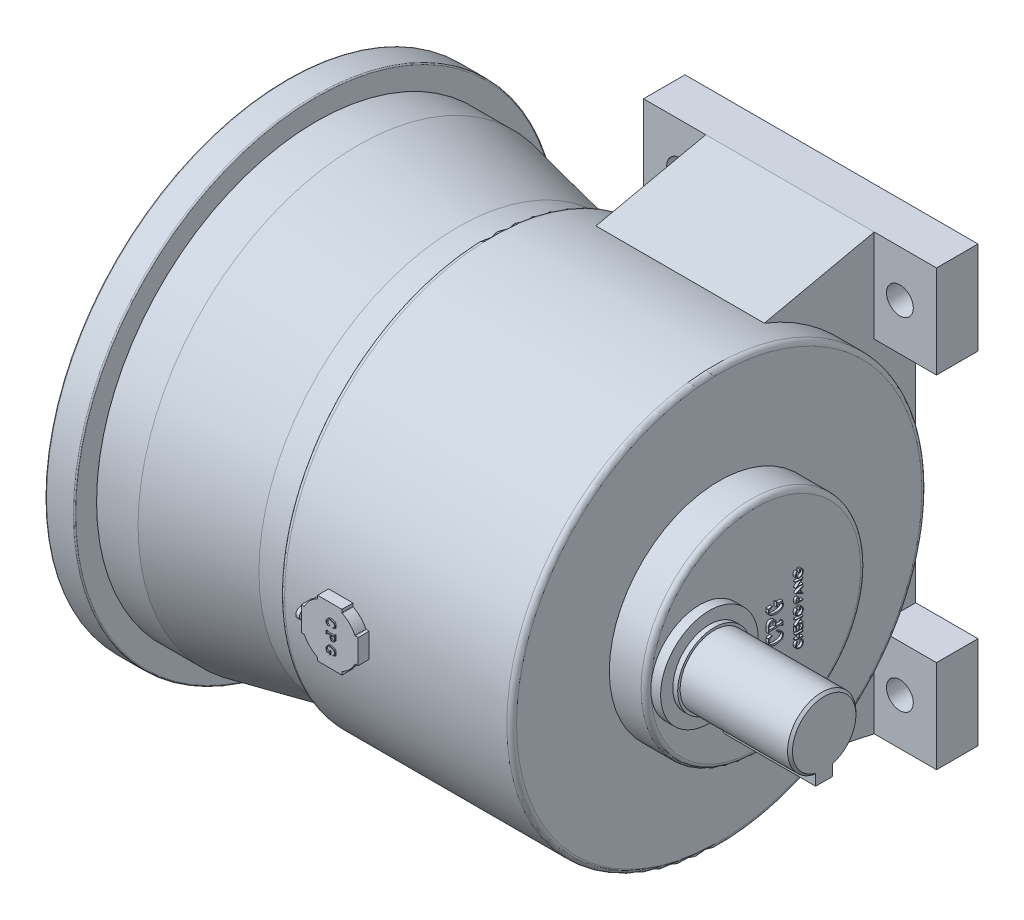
SolidWorks part; units mm, degrees
ref_plane "前视基准面" through (0, 0, 0) normal (0, 0, 1) x (1, 0, 0)
ref_plane "上视基准面" through (0, 0, 0) normal (0, 1, 0) x (1, 0, 0)
ref_plane "右视基准面" through (0, 0, 0) normal (1, 0, 0) x (0, 0, -1)
ref_plane "基准面1" through (0, 0, -116) normal (0, 0, 1) x (1, 0, 0)
sketch "草图1" plane through (0, 0, 0) normal (0, 1, 0) x (1, 0, 0)
  line L0 (0, 0) -> (33.1729, 0) construction
  line L1 (0, 0) -> (0, -14)
  line L2 (0, -14) -> (-45, -14)
  line L3 (-45, -14) -> (-45, -15)
  line L4 (-45, -15) -> (-47, -15)
  line L5 (-47, -15) -> (-47, -20)
  line L6 (-47, -20) -> (-51, -20)
  line L7 (-51, -20) -> (-51, 0)
  line L8 (-51, 0) -> (0, 0)
  dimension "D1" = 45
  dimension "D2" = 28
  dimension "D3" = 30
  dimension "D4" = 2
  dimension "D5" = 40
  dimension "D6" = 4
revolve "旋转1" add sketch "草图1" angle 360 about L0
sketch "草图2" plane through (0, 0, 0) normal (0, 1, 0) x (1, 0, 0)
  line L0 (8.0167, 23) -> (-51, 23) construction
  line L1 (-51, 23) -> (-51, -22)
  line L2 (-51, 20) -> (-51, -20) construction
  line L3 (-51, -22) -> (-66, -22)
  line L4 (-66, -22) -> (-66, -62)
  line L5 (-66, -62) -> (-161, -62)
  line L6 (-161, -62) -> (-161, 23)
  line L11 (-51, 23) -> (-161, 23)
  line L13 (-103.125, 116) -> (103.125, 116) construction
  dimension "D1" = 23
  dimension "D2" = 90
  dimension "D3" = 15
  dimension "D4" = 178
  dimension "D5" = 95
revolve "旋转2" add sketch "草图2" angle 360 about L0
sketch "草图3" plane through (0, 0, -116) normal (0, 0, 1) x (1, 0, 0)
  line L0 (0, 0) -> (40.0459, 0) construction
  line L1 (-173, -51) -> (-53, -51)
  line L2 (-173, -51) -> (-173, -89)
  line L3 (-173, -89) -> (-53, -89)
  line L4 (-53, -51) -> (-53, -89)
  line L5 (0, -14) -> (0, 14) construction
  circle A0 centre (-68, -70) radius 5.5
  circle A1 centre (-158, -70) radius 5.5
  dimension "D2" = 140
  dimension "D3" = 11
  dimension "D4" = 90
  dimension "D6" = 68
  dimension "D8" = 38
  dimension "D1" = 178
  dimension "D5" = 120
  dimension "D7" = 15
extrude "拉伸2" add sketch "草图3" along normal blind 17
mirror "镜向2" about plane through (0, 0, 0) normal (0, 1, 0)
ref_plane "基准面4" through (-113, 0, 0) normal (1, 0, 0) x (0, 0, -1)
sketch "草图4" plane through (-113, 0, 0) normal (1, 0, 0) x (0, 0, -1)
  line L0 (99, 51) -> (116, 51) construction
  line L1 (99, 51) -> (116, 51)
  line L2 (99, 89) -> (99, 51) construction
  line L3 (99, 89) -> (99, 51)
  line L4 (99, -51) -> (116, -51) construction
  line L5 (99, -51) -> (116, -51)
  line L6 (99, -89) -> (99, -51) construction
  line L7 (99, -89) -> (99, -51)
  line L8 (116, 51) -> (116, -51)
  line L9 (99, 89) -> (54, 79.1454)
  line L11 (54, -79.1454) -> (99, -89)
  arc A1 (54, -79.1454) -> (54, 79.1454) centre (23, 0) ccw
  circle A2 centre (23, 0) radius 85 construction
  dimension "D1" = 45
extrude "拉伸3" add sketch "草图4" against normal mid plane 69
sketch "草图5" plane through (0, 0, 0) normal (0, 1, 0) x (1, 0, 0)
  line L0 (0, -3.5) -> (-36.5, -3.5)
  line L1 (0, -14) -> (0, 14) construction
  line L2 (-36.5, 3.5) -> (0, 3.5)
  line L3 (0, 3.5) -> (0, -3.5)
  line L4 (31.1, -13.7955) -> (31.1, 19.6443) construction
  arc A0 (-36.5, -3.5) -> (-36.5, 3.5) centre (-36.5, 0) cw
  dimension "D2" = 40
  dimension "D1" = 7
  dimension "D3" = 31.1
extrude "拉伸4" add sketch "草图5" against normal blind 17.1
fillet "圆角1" radius 2 3 edges at (-161, 0, -108) (-66, 0, -108) (-51, 0, -68)
chamfer "倒角1" distance 1 angle 45 1 edges at (0, 14, 0)
sketch "草圖2" plane through (0, 0, 0) normal (0, 1, 0) x (1, 0, 0)
  line L0 (-229.5028, 23) -> (-161.003, 23)
  line L1 (-242.5028, 122) -> (-231.5028, 122)
  line L2 (-231.0028, 121.5) -> (-231.0028, 113.0026)
  line L3 (-230.9505, 113) -> (-214.0028, 113)
  line L4 (-214.0028, 113) -> (-173.003, 104.5)
  line L5 (-202.0028, 70.375) -> (-202.0028, 71.1207)
  line L6 (-243.0028, 121.5) -> (-243.0028, 88)
  line L7 (-229.0028, 64) -> (-204.0028, 64)
  line L8 (-231.0028, 62) -> (-231.0028, 49)
  line L9 (-268.1011, 23) -> (-139.7895, 23) construction
  line L10 (-243.0028, 88) -> (-238.7028, 88)
  line L11 (-203.3526, 76.0029) -> (-238.7028, 88)
  line L12 (-229.5028, 49) -> (-229.5028, 23)
  line L13 (-200.6869, 73.0001) -> (-200.6869, 73.0215)
  line L14 (-231.0028, 49) -> (-229.5028, 49)
  line L15 (-161.003, 104.5) -> (-161.003, 23)
  line L16 (-173.003, 104.5) -> (-161.003, 104.5)
  arc A0 (-200.6869, 73.0001) -> (-202.0028, 71.1207) centre (-200.0028, 71.1207) ccw
  arc A1 (-204.0028, 64) -> (-202.0028, 70.375) centre (-211.8124, 69.9513) ccw
  arc A2 (-229.0028, 64) -> (-231.0028, 62) centre (-229.0028, 62) ccw
  arc A6 (-200.6869, 73.0215) -> (-203.3526, 76.0029) centre (-203.6869, 73.0215) ccw
  arc A7 (-231.0028, 113.0026) -> (-230.9505, 113) centre (-230.9505, 113.5232) ccw
  arc A8 (-242.5028, 122) -> (-243.0028, 121.5) centre (-242.5028, 121.5) ccw
  arc A9 (-231.0028, 121.5) -> (-231.5028, 122) centre (-231.5028, 121.5) ccw
  dimension "D1" = 198
  dimension "D2" = 130
  dimension "D6" = 81.9998
  dimension "D14" = 23
  dimension "D15" = 243.0028
revolve "旋轉2" add sketch "草圖2" angle 360 about L9
sketch "草圖4" plane through (-243.0028, 0, 0) normal (-1, 0, 0) x (0, 0, 1)
  line L0 (-23, 0) -> (-23, 120.5316) construction
  circle A0 centre (-23, 0) radius 82.5 construction
  circle A1 centre (-81.3363, 58.3363) radius 5
  circle A2 centre (35.3363, 58.3363) radius 5
  circle A3 centre (35.3363, -58.3363) radius 5
  circle A4 centre (-81.3363, -58.3363) radius 5
  dimension "D1" = 165
  dimension "D2" = 10
extrude "伸長1" cut sketch "草圖4" against normal blind 25
sketch "草圖5" plane through (-243.0028, 0, 0) normal (-1, 0, 0) x (0, 0, 1)
  line L2 (0.0903, 52.4023) -> (8.1223, 70.6304)
  line L30 (-69.1366, 59.1698) -> (-76.033, 53.033)
  line L31 (-82.1698, 46.1366) -> (-76.033, 53.033)
  line L32 (0.0903, -52.4023) -> (8.1223, -70.6304)
  line L33 (-50.4054, 49.5204) -> (-57.6515, 58.2893)
  line L34 (26.5204, 27.4054) -> (35.2893, 34.6515)
  line L35 (4.4054, -49.5204) -> (11.6515, -58.2893)
  line L36 (-75.4023, -23.0903) -> (-93.6304, -31.1223)
  line L37 (4.4054, 49.5204) -> (11.6515, 58.2893)
  line L38 (23.1366, -59.1698) -> (30.033, -53.033)
  line L39 (29.4023, -23.0903) -> (47.6304, -31.1223)
  line L40 (-23, 0) -> (-107.5, 0) construction
  line L41 (-50.4054, -49.5204) -> (-57.6515, -58.2893)
  line L42 (-23, 0) -> (61.5, 0) construction
  line L43 (-72.5204, -27.4054) -> (-81.2893, -34.6515)
  line L44 (-46.0903, 52.4023) -> (-54.1223, 70.6304)
  line L45 (-23, 0) -> (-113.6873, 90.6873) construction
  line L46 (-23, 0) -> (-23, -84.5) construction
  line L47 (29.4023, 23.0903) -> (47.6304, 31.1223)
  line L48 (26.5204, -27.4054) -> (35.2893, -34.6515)
  line L49 (36.1698, -46.1366) -> (30.033, -53.033)
  line L50 (-46.0903, -52.4023) -> (-54.1223, -70.6304)
  line L51 (-75.4023, 23.0903) -> (-93.6304, 31.1223)
  line L52 (-72.5204, 27.4054) -> (-81.2893, 34.6515)
  line L53 (23.1366, 59.1698) -> (30.033, 53.033)
  line L54 (-69.1366, -59.1698) -> (-76.033, -53.033)
  line L55 (-23, 0) -> (-23, 84.5) construction
  line L56 (36.1698, 46.1366) -> (30.033, 53.033)
  line L57 (-82.1698, -46.1366) -> (-76.033, -53.033)
  arc A48 (-103.0874, 26.949) -> (-93.6304, 31.1223) centre (-96.453, 24.7166) cw
  arc A50 (29.4023, -23.0903) -> (26.5308, -23.9103) centre (28.3319, -24.7798) ccw
  arc A51 (3.949, -80.0874) -> (-23, -84.5) centre (-23, 0) cw
  arc A52 (-46.0903, 52.4023) -> (-46.9103, 49.5308) centre (-47.7798, 51.3319) cw
  arc A53 (-72.0121, 24.9562) -> (-72.5204, 27.4054) centre (-73.7944, 25.8637) ccw
  arc A54 (3.949, -80.0874) -> (8.1223, -70.6304) centre (1.7166, -73.453) ccw
  arc A55 (-49.949, -80.0874) -> (-23, -84.5) centre (-23, 0) ccw
  arc A56 (-72.0121, 24.9562) -> (-72.5308, 23.9103) centre (-23, 0) ccw
  arc A57 (-69.1366, 59.1698) -> (-57.6515, 58.2893) centre (-63.8184, 53.1934) cw
  arc A58 (1.9562, 49.0121) -> (0.9103, 49.5308) centre (-23, 0) ccw
  arc A59 (26.0121, 24.9562) -> (26.5204, 27.4054) centre (27.7944, 25.8637) cw
  arc A60 (1.9562, -49.0121) -> (0.9103, -49.5308) centre (-23, 0) cw
  arc A61 (-69.1366, -59.1698) -> (-57.6515, -58.2893) centre (-63.8184, -53.1934) ccw
  arc A62 (-72.0121, -24.9562) -> (-72.5204, -27.4054) centre (-73.7944, -25.8637) cw
  arc A63 (-47.9562, 49.0121) -> (-50.4054, 49.5204) centre (-48.8637, 50.7944) cw
  arc A64 (1.9562, 49.0121) -> (4.4054, 49.5204) centre (2.8637, 50.7944) ccw
  arc A65 (57.0874, 26.949) -> (61.5, 0) centre (-23, 0) cw
  arc A66 (0.0903, -52.4023) -> (0.9103, -49.5308) centre (1.7798, -51.3319) cw
  arc A67 (-49.949, -80.0874) -> (-54.1223, -70.6304) centre (-47.7166, -73.453) cw
  arc A68 (-47.9562, -49.0121) -> (-50.4054, -49.5204) centre (-48.8637, -50.7944) ccw
  arc A69 (-72.0121, -24.9562) -> (-72.5308, -23.9103) centre (-23, 0) cw
  arc A70 (36.1698, -46.1366) -> (35.2893, -34.6515) centre (30.1934, -40.8184) ccw
  arc A71 (29.4023, 23.0903) -> (26.5308, 23.9103) centre (28.3319, 24.7798) cw
  arc A72 (57.0874, -26.949) -> (61.5, 0) centre (-23, 0) ccw
  circle A73 centre (-23, 0) radius 50
  arc A74 (-82.1698, 46.1366) -> (-81.2893, 34.6515) centre (-76.1934, 40.8184) ccw
  arc A75 (-49.949, 80.0874) -> (-23, 84.5) centre (-23, 0) cw
  arc A76 (23.1366, -59.1698) -> (11.6515, -58.2893) centre (17.8184, -53.1934) cw
  arc A77 (-75.4023, 23.0903) -> (-72.5308, 23.9103) centre (-74.3319, 24.7798) ccw
  arc A78 (3.949, 80.0874) -> (-23, 84.5) centre (-23, 0) ccw
  arc A79 (57.0874, 26.949) -> (47.6304, 31.1223) centre (50.453, 24.7166) ccw
  arc A80 (1.9562, -49.0121) -> (4.4054, -49.5204) centre (2.8637, -50.7944) cw
  arc A81 (-82.1698, -46.1366) -> (-81.2893, -34.6515) centre (-76.1934, -40.8184) cw
  arc A82 (57.0874, -26.949) -> (47.6304, -31.1223) centre (50.453, -24.7166) cw
  arc A83 (36.1698, 46.1366) -> (35.2893, 34.6515) centre (30.1934, 40.8184) cw
  arc A84 (26.0121, -24.9562) -> (26.5204, -27.4054) centre (27.7944, -25.8637) ccw
  arc A85 (-46.0903, -52.4023) -> (-46.9103, -49.5308) centre (-47.7798, -51.3319) ccw
  arc A86 (23.1366, 59.1698) -> (11.6515, 58.2893) centre (17.8184, 53.1934) ccw
  arc A87 (0.0903, 52.4023) -> (0.9103, 49.5308) centre (1.7798, 51.3319) ccw
  arc A88 (-47.9562, -49.0121) -> (-46.9103, -49.5308) centre (-23, 0) ccw
  arc A89 (-103.0874, -26.949) -> (-93.6304, -31.1223) centre (-96.453, -24.7166) ccw
  arc A90 (-47.9562, 49.0121) -> (-46.9103, 49.5308) centre (-23, 0) cw
  arc A91 (3.949, 80.0874) -> (8.1223, 70.6304) centre (1.7166, 73.453) cw
  arc A92 (26.0121, 24.9562) -> (26.5308, 23.9103) centre (-23, 0) cw
  arc A93 (-103.0874, -26.949) -> (-107.5, 0) centre (-23, 0) cw
  arc A94 (-75.4023, -23.0903) -> (-72.5308, -23.9103) centre (-74.3319, -24.7798) cw
  arc A95 (-103.0874, 26.949) -> (-107.5, 0) centre (-23, 0) ccw
  arc A96 (-49.949, 80.0874) -> (-54.1223, 70.6304) centre (-47.7166, 73.453) ccw
  arc A97 (26.0121, -24.9562) -> (26.5308, -23.9103) centre (-23, 0) ccw
  point P145 (-62.9374, 64.6861)
  point P174 (41.6861, 39.9374)
  point P202 (16.9374, -64.6861)
  point P229 (-87.6861, -39.9374)
extrude "伸長2" cut sketch "草圖5" against normal blind 55 draft 1
sketch "草圖7" plane through (-229.5028, 0, 0) normal (-1, 0, 0) x (0, 0, 1)
  line L0 (-46.2551, 0) -> (0.2551, 0) construction
  line L1 (-23, 23.2551) -> (-23, -23.2551) construction
  line L2 (-10.7, 3) -> (-10.7, -3)
  line L3 (-13.4606, 3) -> (-14.1682, 3.5)
  line L4 (-10.7, 3) -> (-13.4606, 3)
  line L5 (-13.4606, -3) -> (-14.1682, -3.5)
  line L6 (-10.7, -3) -> (-13.4606, -3)
  arc A0 (-14.1682, 3.5) -> (-14.1682, -3.5) centre (-23, 0) ccw
  circle A1 centre (-23, 0) radius 19.9 construction
  dimension "D1" = 9.5
extrude "伸長4" cut sketch "草圖7" against normal blind 40
sketch "草圖8" plane through (-229.5028, 0, 0) normal (-1, 0, 0) x (0, 0, 1)
  line L0 (-10.7, 3) -> (-13.4606, 3) construction
  line L1 (-10.7, 3) -> (-10.7, -3) construction
  line L2 (-10.7, -3) -> (-13.4606, -3) construction
  line L3 (-10.7, 3) -> (-13.4606, 3)
  line L4 (-10.7, 3) -> (-10.7, -3)
  line L5 (-10.7, -3) -> (-13.4606, -3)
  circle A0 centre (-23, 0) radius 19.9 construction
  circle A1 centre (-23, 0) radius 19.9
  arc A2 (-14.1682, 3.5) -> (-14.1682, -3.5) centre (-23, 0) ccw construction
  arc A3 (-14.1682, 3.5) -> (-14.1682, -3.5) centre (-23, 0) ccw
extrude "伸長5" add sketch "草圖8" along normal blind 1 contours A1 M6 M1 M2 M3 M4 M5
sketch "草圖9" plane through (-188.0028, 0, 0) normal (-1, 0, 0) x (0, 0, 1)
  circle A0 centre (-23, 0) radius 66.5 construction
  circle A1 centre (-70.0226, 47.0226) radius 3.5
  circle A2 centre (24.0226, 47.0226) radius 3.5
  circle A3 centre (24.0226, -47.0226) radius 3.5
  circle A4 centre (-70.0226, -47.0226) radius 3.5
  dimension "D1" = 133
  dimension "D2" = 7
extrude "伸長6" cut sketch "草圖9" against normal blind 11
sketch "草圖10"
extrude "伸長7" add sketch "草圖10" along normal blind 1
ref_plane "平面1" through (0, 0, 66.5) normal (0, 0, 1) x (1, 0, 0)
sketch "草圖11" plane through (0, 0, 66.5) normal (0, 0, 1) x (1, 0, 0)
  line L0 (-141, 11.65) -> (-131, 11.65)
  line L1 (-141, 11.65) -> (-141, 10.5119)
  line L2 (-131, 11.65) -> (-131, 10.5119)
  line L3 (-141, -10.5119) -> (-141, -11.65)
  line L4 (-131, -10.5119) -> (-131, -11.65)
  line L5 (-147.65, 5) -> (-146.5119, 5)
  line L6 (-147.65, -5) -> (-146.5119, -5)
  line L7 (-147.65, -5) -> (-147.65, 5)
  line L8 (-141, -11.65) -> (-141, -10.5119)
  line L9 (-131, -11.65) -> (-131, -10.5119)
  line L10 (-131, -11.65) -> (-141, -11.65)
  line L11 (-124.35, -5) -> (-125.4881, -5)
  line L12 (-124.35, 5) -> (-125.4881, 5)
  line L13 (-124.35, 5) -> (-124.35, -5)
  arc A0 (-141.1383, 10.2882) -> (-146.2882, 5.1383) centre (-136, 0) ccw
  arc A1 (-141.1383, 10.2882) -> (-141, 10.5119) centre (-141.25, 10.5119) ccw
  arc A2 (-131, 10.5119) -> (-130.8617, 10.2882) centre (-130.75, 10.5119) ccw
  arc A3 (-146.5119, 5) -> (-146.2882, 5.1383) centre (-146.5119, 5.25) ccw
  arc A4 (-146.2882, -5.1383) -> (-146.5119, -5) centre (-146.5119, -5.25) ccw
  arc A5 (-141, -10.5119) -> (-141.1383, -10.2882) centre (-141.25, -10.5119) ccw
  arc A6 (-130.8617, -10.2882) -> (-131, -10.5119) centre (-130.75, -10.5119) ccw
  arc A7 (-125.4881, -5) -> (-125.7118, -5.1383) centre (-125.4881, -5.25) ccw
  arc A8 (-125.7118, 5.1383) -> (-125.4881, 5) centre (-125.4881, 5.25) ccw
  arc A9 (-125.7118, 5.1383) -> (-130.8617, 10.2882) centre (-136, 0) ccw
  arc A10 (-146.2882, -5.1383) -> (-141.1383, -10.2882) centre (-136, 0) ccw
  arc A11 (-130.8617, -10.2882) -> (-125.7118, -5.1383) centre (-136, 0) ccw
  dimension "D1" = 11.5
extrude "伸長8" add sketch "草圖11" against normal blind 4.5 separate body contours A6 A11 A7 L11 L13 L12 A8 A9 A2 L2 L0 L1 A1 A0 A3 L5 L7 L6 A4 A10 A5 L3 L10 L4
sketch "草圖12"
extrude "伸長9" add sketch "草圖12" along normal blind 0.5
sketch "草圖13" plane through (0, 0, 0) normal (0, 1, 0) x (1, 0, 0)
  line L0 (-150.1623, -64.25) -> (-142.1623, -64.25)
  line L1 (-150.1623, -64.25) -> (-150.1623, -62.25)
  line L2 (-148.6623, -63) -> (-148.6623, -62.25)
  line L13 (-146.6623, -63) -> (-142.1623, -63.25)
  line L15 (-148.6623, -63) -> (-146.6623, -63)
  line L23 (-150.1623, -62.25) -> (-148.6623, -62.25)
  line L24 (-146.6623, -64.25) -> (-146.6623, -63)
  line L25 (-142.1623, -64.25) -> (-142.1623, -63.25)
revolve "旋轉3" add sketch "草圖13" angle 360 about L0
equation "\"D7@草图3\"=(\"D5@草图3\"-\"D4@草图3\")/2"
equation "\"D8@草图3\" = \"D1@草图3\"-\"D2@草图3\""
equation "\"D1@拉伸4\" = \"D3@草图5\"-\"D2@草图1\"/2"
equation "\"D3@草图1\"=\"D2@草图1\"+2"
equation "\"D5@草图2\"=\"D5@草图3\"-25"
equation "\"D1@基准面4\" = \"D5@草图3\"/2"
equation "\"D1@拉伸3\" = \"D4@草图3\"-\"D3@草图3\"-10"
